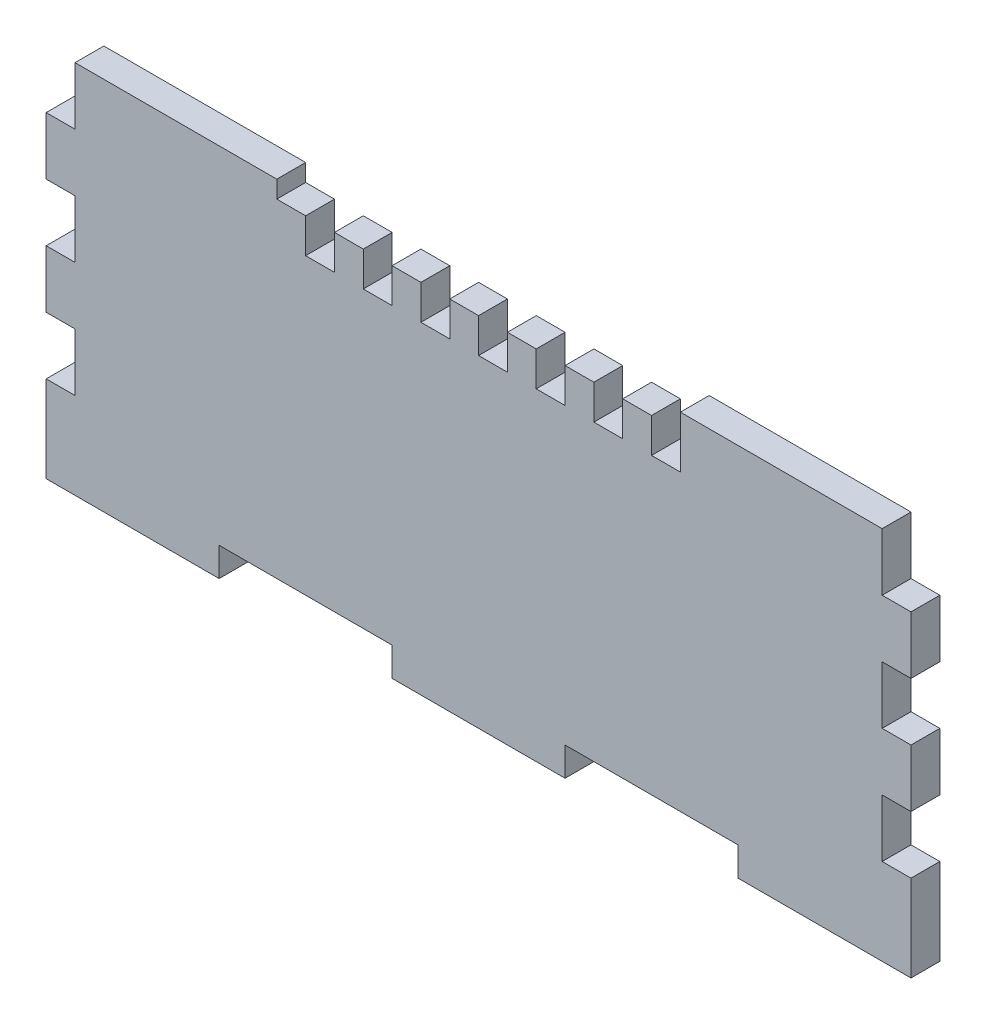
SolidWorks part; units mm, degrees
ref_plane "Front Plane" through (0, 0, 0) normal (0, 0, 1) x (1, 0, 0)
ref_plane "Top Plane" through (0, 0, 0) normal (0, 1, 0) x (1, 0, 0)
ref_plane "Right Plane" through (0, 0, 0) normal (1, 0, 0) x (0, 0, -1)
sketch "Sketch1" plane through (0, 0, 0) normal (0, 0, 1) x (1, 0, 0)
  line L1 (0, 0) -> (381, 0)
  line L2 (0, 0) -> (0, 152.4)
  line L3 (0, 152.4) -> (381, 152.4)
  line L4 (381, 0) -> (381, 152.4)
  dimension "D1" = 152.4
  dimension "D2" = 381
extrude "Boss-Extrude1" add sketch "Sketch1" along normal blind 12.7
sketch "Sketch2" plane through (0, 0, 0) normal (0, -1, 0) x (1, 0, 0)
  line L0 (0, 0) -> (0, 12.7)
  line L1 (76.2, 0) -> (76.2, 12.7)
  line L2 (381, 12.7) -> (381, 0)
  line L3 (304.8, 12.7) -> (304.8, 0)
  line L4 (152.4, 0) -> (152.4, 12.7)
  line L5 (228.6, 12.7) -> (228.6, 0)
  line L6 (0, 12.7) -> (381, 12.7)
  line L7 (0, 0) -> (381, 0)
  dimension "D1" = 76.2
  dimension "D2" = 76.2
  dimension "D3" = 76.2
extrude "Boss-Extrude2" add sketch "Sketch2" along normal blind 12.7 contours L1 M1 M3 M4 | L5 L4 M3 M1 | L3 M3 M1 M2 | L7 L2 L6 L0
sketch "Sketch3" plane through (0, 0, 12.7) normal (0, 0, 1) x (1, 0, 0)
  line L0 (0, 152.4) -> (381, 152.4)
  line L1 (0, 127) -> (381, 127)
  line L2 (0, 101.6) -> (381, 101.6)
  line L3 (0, 76.2) -> (381, 76.2)
  line L4 (0, 50.8) -> (381, 50.8)
  line L5 (0, 25.4) -> (381, 25.4)
  line L6 (0, 0) -> (381, 0)
  line L7 (12.7, 152.4) -> (12.7, -33.7799)
  line L8 (368.3, 152.4) -> (368.3, -50.9013)
  line L9 (381, -12.7) -> (381, 152.4) construction
  line L10 (0, 152.4) -> (0, -12.7) construction
  dimension "D7" = 12.7
  dimension "D8" = 12.7
  dimension "D1" = 25.4
  dimension "D2" = 25.4
  dimension "D3" = 25.4
  dimension "D4" = 25.4
  dimension "D5" = 25.4
  dimension "D6" = 25.4
extrude "Cut-Extrude1" cut sketch "Sketch3" against normal through all and the other way through all contours L7 L0 L1 M1 | L7 L2 L3 M1 | L7 L4 L5 M1 | L4 L8 L5 M11 | L2 L8 L3 M11 | L8 L1 M12 M11
sketch "Sketch4" plane through (0, 0, 0) normal (0, 0, -1) x (-1, 0, 0)
  line L0 (-12.7, 127) -> (-12.7, 152.4) construction
  line L1 (-368.3, 152.4) -> (-12.7, 152.4)
  line L2 (-368.3, 152.4) -> (-368.3, 129.54)
  line L3 (-368.3, 129.54) -> (-12.7, 129.54)
  line L4 (-12.7, 152.4) -> (-12.7, 129.54)
  line L5 (-355.6, 152.4) -> (-355.6, 129.54)
  line L6 (-342.9, 152.4) -> (-342.9, 129.54)
  line L7 (-330.2, 152.4) -> (-330.2, 129.54)
  line L8 (-317.5, 152.4) -> (-317.5, 129.54)
  line L9 (-304.8, 152.4) -> (-304.8, 129.54)
  line L10 (-292.1, 152.4) -> (-292.1, 129.54)
  line L11 (-279.4, 152.4) -> (-279.4, 129.54)
  line L12 (-266.7, 152.4) -> (-266.7, 129.54)
  line L13 (-254, 152.4) -> (-254, 129.54)
  line L14 (-241.3, 152.4) -> (-241.3, 129.54)
  line L15 (-228.6, 152.4) -> (-228.6, 129.54)
  line L16 (-215.9, 152.4) -> (-215.9, 129.54)
  line L17 (-203.2, 152.4) -> (-203.2, 129.54)
  line L18 (-190.5, 152.4) -> (-190.5, 129.54)
  line L19 (-177.8, 152.4) -> (-177.8, 129.54)
  line L20 (-165.1, 152.4) -> (-165.1, 129.54)
  line L21 (-152.4, 152.4) -> (-152.4, 129.54)
  line L22 (-139.7, 152.4) -> (-139.7, 129.54)
  line L23 (-127, 152.4) -> (-127, 129.54)
  line L24 (-114.3, 152.4) -> (-114.3, 129.54)
  line L25 (-101.6, 152.4) -> (-101.6, 129.54)
  line L26 (-88.9, 152.4) -> (-88.9, 129.54)
  line L27 (-76.2, 152.4) -> (-76.2, 129.54)
  line L28 (-63.5, 152.4) -> (-63.5, 129.54)
  line L29 (-50.8, 152.4) -> (-50.8, 129.54)
  line L30 (-38.1, 152.4) -> (-38.1, 129.54)
  line L31 (-25.4, 152.4) -> (-25.4, 129.54)
  dimension "D1" = 22.86
  dimension "D2" = 28
extrude "Cut-Extrude2" cut sketch "Sketch4" against normal blind 12.7 contours L12 L1 L11 L3 | L14 L1 L13 L3 | L16 L1 L15 L3 | L18 L1 L17 L3 | L20 L1 L19 L3 | L22 L1 L21 L3 | L24 L1 L23 L3
sketch "Sketch5" plane through (0, 0, 0) normal (0, 0, -1) x (-1, 0, 0)
  line L0 (-241.3, 152.4) -> (-241.3, 129.54) construction
  line L1 (-254, 152.4) -> (-241.3, 152.4)
  line L2 (-254, 152.4) -> (-254, 144.78)
  line L3 (-254, 144.78) -> (-241.3, 144.78)
  line L4 (-241.3, 152.4) -> (-241.3, 144.78)
  line L5 (-215.9, 152.4) -> (-215.9, 129.54) construction
  line L6 (-228.6, 152.4) -> (-215.9, 152.4)
  line L7 (-228.6, 152.4) -> (-228.6, 144.78)
  line L8 (-228.6, 144.78) -> (-215.9, 144.78)
  line L9 (-215.9, 152.4) -> (-215.9, 144.78)
  line L10 (-190.5, 152.4) -> (-190.5, 129.54) construction
  line L11 (-203.2, 152.4) -> (-190.5, 152.4)
  line L12 (-203.2, 152.4) -> (-203.2, 144.78)
  line L13 (-203.2, 144.78) -> (-190.5, 144.78)
  line L14 (-190.5, 152.4) -> (-190.5, 144.78)
  line L15 (-165.1, 152.4) -> (-165.1, 129.54) construction
  line L16 (-177.8, 152.4) -> (-165.1, 152.4)
  line L17 (-177.8, 152.4) -> (-177.8, 144.78)
  line L18 (-177.8, 144.78) -> (-165.1, 144.78)
  line L19 (-165.1, 152.4) -> (-165.1, 144.78)
  line L20 (-139.7, 152.4) -> (-139.7, 129.54) construction
  line L21 (-152.4, 152.4) -> (-139.7, 152.4)
  line L22 (-152.4, 152.4) -> (-152.4, 144.78)
  line L23 (-152.4, 144.78) -> (-139.7, 144.78)
  line L24 (-139.7, 152.4) -> (-139.7, 144.78)
  line L26 (-127, 152.4) -> (-114.3, 152.4)
  line L27 (-127, 152.4) -> (-127, 144.78)
  line L28 (-127, 144.78) -> (-114.3, 144.78)
  line L29 (-114.3, 152.4) -> (-114.3, 144.78)
  line L31 (-266.7, 152.4) -> (-254, 152.4)
  line L32 (-266.7, 152.4) -> (-266.7, 144.78)
  line L33 (-266.7, 144.78) -> (-254, 144.78)
  line L34 (-254, 152.4) -> (-254, 144.78)
  line L35 (-241.3, 152.4) -> (-228.6, 152.4)
  line L36 (-241.3, 152.4) -> (-241.3, 144.78)
  line L37 (-241.3, 144.78) -> (-228.6, 144.78)
  line L38 (-228.6, 152.4) -> (-228.6, 144.78)
  line L39 (-215.9, 152.4) -> (-203.2, 152.4)
  line L40 (-215.9, 152.4) -> (-215.9, 144.78)
  line L41 (-215.9, 144.78) -> (-203.2, 144.78)
  line L42 (-203.2, 152.4) -> (-203.2, 144.78)
  line L43 (-190.5, 152.4) -> (-177.8, 152.4)
  line L44 (-190.5, 152.4) -> (-190.5, 144.78)
  line L45 (-190.5, 144.78) -> (-177.8, 144.78)
  line L46 (-177.8, 152.4) -> (-177.8, 144.78)
  line L47 (-165.1, 152.4) -> (-152.4, 152.4)
  line L48 (-165.1, 152.4) -> (-165.1, 144.78)
  line L49 (-165.1, 144.78) -> (-152.4, 144.78)
  line L50 (-152.4, 152.4) -> (-152.4, 144.78)
  line L51 (-139.7, 152.4) -> (-127, 152.4)
  line L52 (-139.7, 152.4) -> (-139.7, 144.78)
  line L53 (-139.7, 144.78) -> (-127, 144.78)
  line L54 (-127, 152.4) -> (-127, 144.78)
  line L55 (-114.3, 152.4) -> (-101.6, 152.4)
  line L56 (-114.3, 152.4) -> (-114.3, 144.78)
  line L57 (-114.3, 144.78) -> (-101.6, 144.78)
  line L58 (-101.6, 152.4) -> (-101.6, 144.78)
  dimension "D1" = 7.62
  dimension "D2" = 12.7
extrude "Cut-Extrude3" cut sketch "Sketch5" against normal blind 12.7 contours L32 L33 L2 L31 | L4 L37 L7 L35 | L9 L41 L12 L39 | L14 L45 L17 L43 | L19 L49 L22 L47 | L58 L55 L29 L57 | L24 L53 L27 L51
